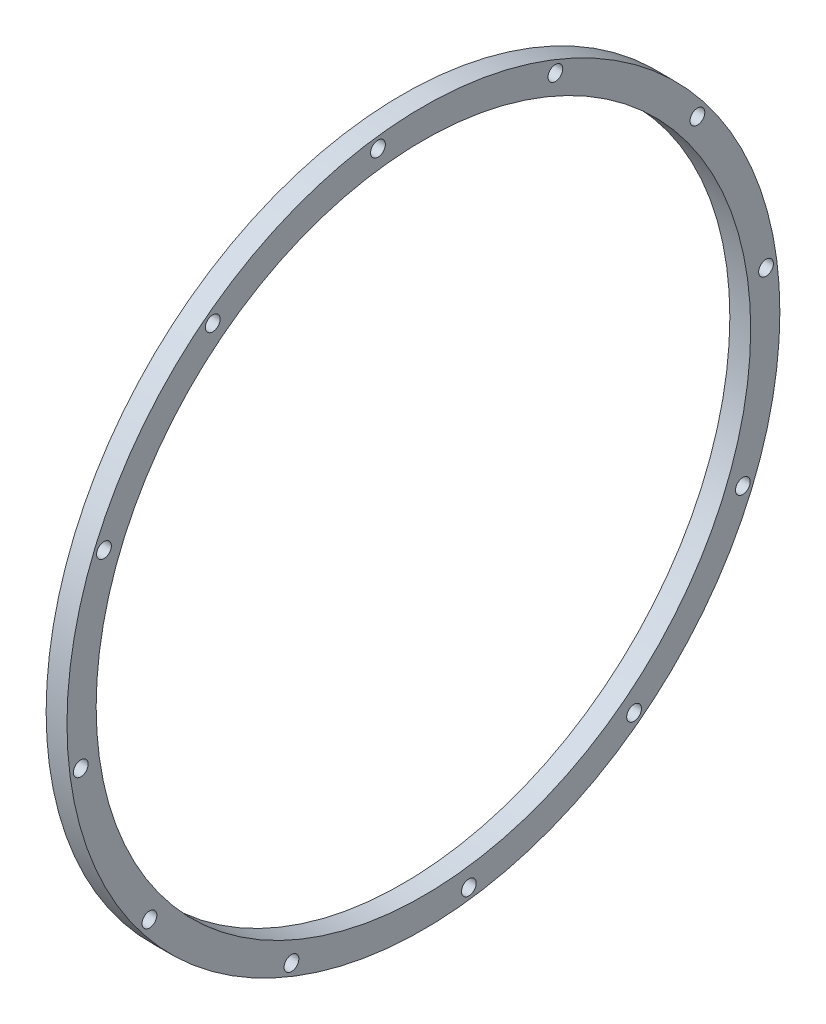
SolidWorks part; units mm, degrees
ref_plane "Front Plane" through (0, 0, 0) normal (0, 0, 1) x (1, 0, 0)
ref_plane "Top Plane" through (0, 0, 0) normal (0, 1, 0) x (1, 0, 0)
ref_plane "Right Plane" through (0, 0, 0) normal (1, 0, 0) x (0, 0, -1)
sketch "Sketch1" plane through (0, 0, 0) normal (1, 0, 0) x (0, 0, -1)
  circle A0 centre (0, 0) radius 108.585
extrude "Boss-Extrude1" add sketch "Sketch1" along normal blind 6.35
sketch "Sketch2" plane through (6.35, 0, 0) normal (1, 0, 0) x (0, 0, -1)
  circle A0 centre (0, 0) radius 99.695
  dimension "D1" = 199.39
extrude "Cut-Extrude1" cut sketch "Sketch2" against normal blind 6.35
hole_wizard "#8 Clearance Hole1" positions "Sketch3" profile "Sketch4" hole size "#8" standard "ANSI Inch"
sketch "Sketch3" plane through (6.35, 0, 0) normal (1, 0, 0) x (0, 0, -1)
  circle A0 centre (0, 0) radius 99.695 construction
  point P0 (40.1976, 97.307)
  dimension "D1" = 105.283
sketch "Sketch4" plane through (6.35, 97.307, -40.1976) normal (0, 1, 0) x (0, 0, -1)
  line L0 (0, 0) -> (0, 6.35)
  line L1 (0, 6.35) -> (2.2479, 6.35)
  line L2 (2.2479, 6.35) -> (2.2479, 0)
  line L5 (2.2479, 0) -> (0, 0)
  line L11 (0, -6.35) -> (0, 107.95) construction
  dimension "Thru Hole Dia." = 4.4958
  dimension "Thru Hole Depth" = 6.35
pattern_circular "CirPattern1" count 12 over 360 about axis through (0, 0, 0) along (1, 0, 0) of "#8 Clearance Hole1"
